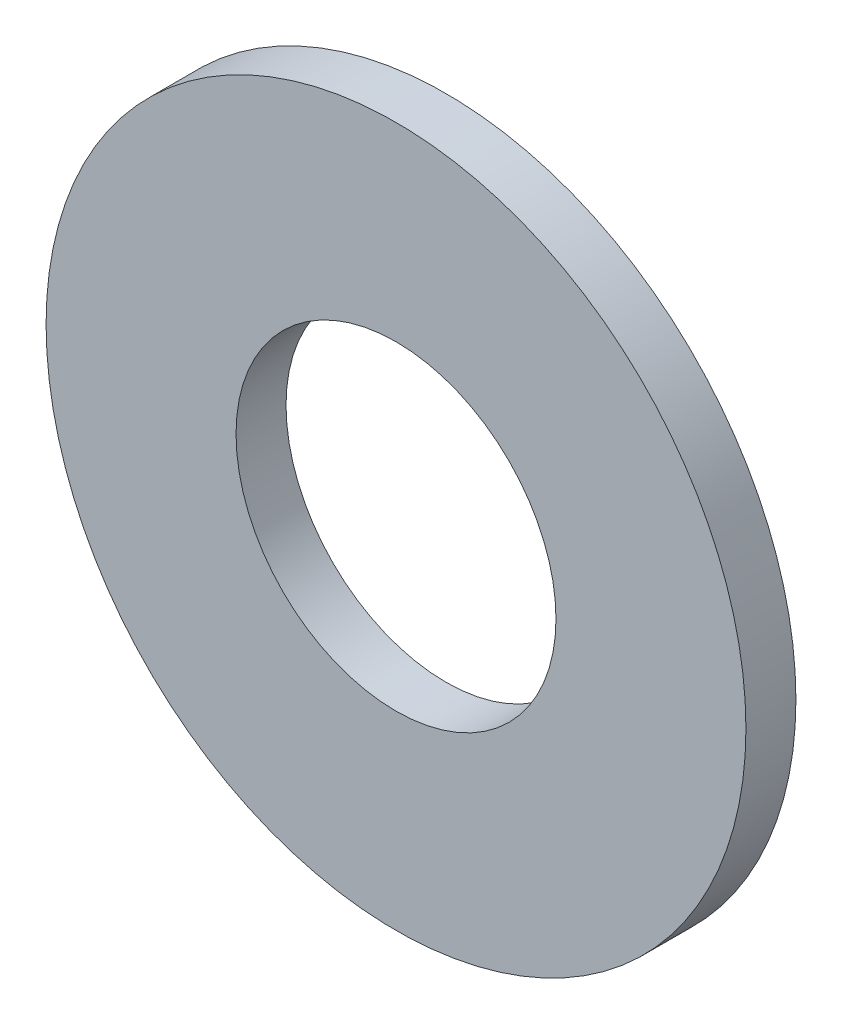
SolidWorks part; units mm, degrees
ref_plane "前视基准面" through (0, 0, 0) normal (0, 0, 1) x (1, 0, 0)
ref_plane "上视基准面" through (0, 0, 0) normal (0, 1, 0) x (1, 0, 0)
ref_plane "右视基准面" through (0, 0, 0) normal (1, 0, 0) x (0, 0, -1)
other "Configuration Table"
sketch "草图1" plane through (0, 0, 0) normal (0, 0, 1) x (1, 0, 0)
  circle A0 centre (0, 0) radius 3.5
  circle A1 centre (0, 0) radius 1.6
  dimension "D1" = 3.2
  dimension "D2" = 7
extrude "Washer_envelope" add sketch "草图1" along normal blind 0.5
